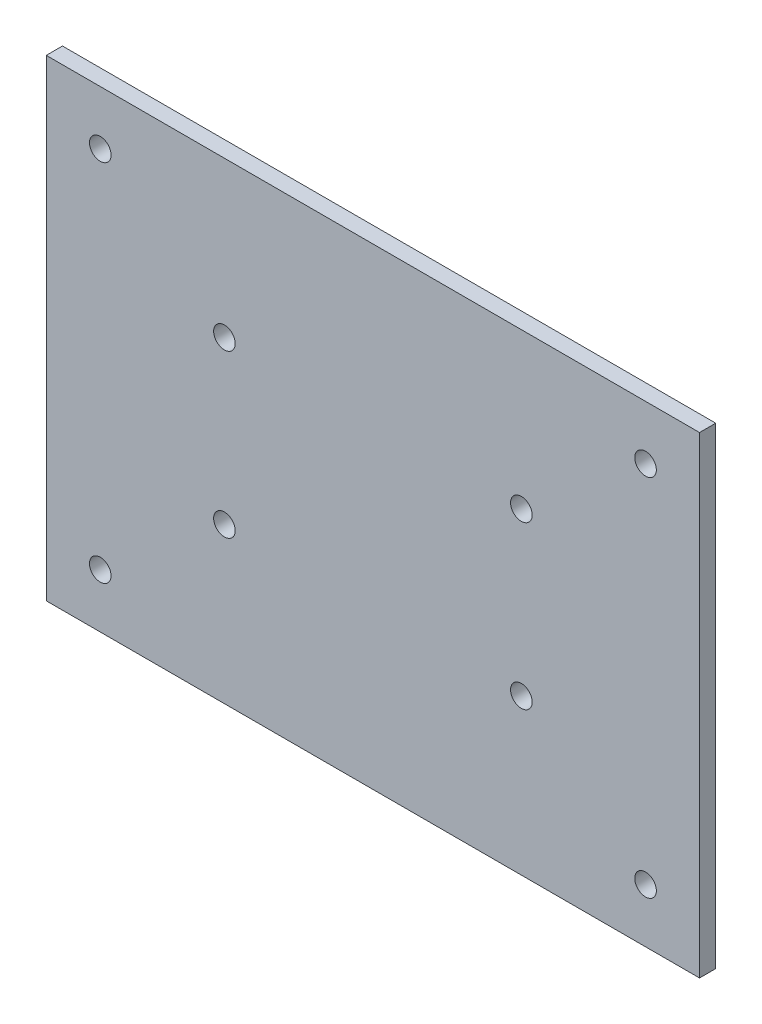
SolidWorks part; units mm, degrees
ref_plane "前视基准面" through (0, 0, 0) normal (0, 0, 1) x (1, 0, 0)
ref_plane "上视基准面" through (0, 0, 0) normal (0, 1, 0) x (1, 0, 0)
ref_plane "右视基准面" through (0, 0, 0) normal (1, 0, 0) x (0, 0, -1)
sketch "草图1" plane through (0, 0, 0) normal (0, 0, 1) x (1, 0, 0)
  line L1 (-60.5, 43.75) -> (60.5, 43.75)
  line L2 (-60.5, 43.75) -> (-60.5, -43.75)
  line L3 (-60.5, -43.75) -> (60.5, -43.75)
  line L4 (60.5, 43.75) -> (60.5, -43.75)
  line L5 (-60.5, 43.75) -> (60.5, -43.75) construction
  line L6 (-60.5, -43.75) -> (60.5, 43.75) construction
  point P0 (0, 0)
  dimension "D1" = 87.5
  dimension "D2" = 121
extrude "凸台-拉伸1" add sketch "草图1" along normal blind 3
hole_wizard "Ø4.0 (4) 直径孔1" positions "草图3" profile "草图4" hole size "Ø4.0" standard "GB"
sketch "草图3" plane through (0, 0, 3) normal (0, 0, 1) x (1, 0, 0)
  point P0 (-27.5, 15)
  point P2 (-27.5, -15)
  point P4 (27.5, 15)
  point P6 (27.5, -15)
  dimension "D1" = 30
  dimension "D2" = 30
  dimension "D3" = 15
  dimension "D4" = 15
  dimension "D5" = 27.5
  dimension "D6" = 27.5
  dimension "D7" = 27.5
  dimension "D8" = 27.5
sketch "草图4" plane through (-27.5, 15, 3) normal (1, 0, 0) x (0, -1, 0)
  line L0 (0, 0) -> (0, 3)
  line L1 (0, 3) -> (2, 3)
  line L2 (2, 3) -> (2, 0)
  line L5 (2, 0) -> (0, 0)
  line L11 (0, -6.35) -> (0, 107.95) construction
  dimension "通孔孔直径" = 4
  dimension "通孔孔深度" = 3
hole_wizard "Ø4.0 (4) 直径孔2" positions "草图5" profile "草图6" hole size "Ø4.0" standard "GB"
sketch "草图5" plane through (0, 0, 3) normal (0, 0, 1) x (1, 0, 0)
  line L0 (60.5, 43.75) -> (-60.5, 43.75) construction
  line L1 (-60.5, 43.75) -> (-60.5, -43.75) construction
  line L2 (60.5, -43.75) -> (60.5, 43.75) construction
  line L3 (-60.5, -43.75) -> (60.5, -43.75) construction
  point P0 (-50.5, 33.75)
  point P2 (-50.5, -33.75)
  point P4 (50.5, 33.75)
  point P6 (50.5, -33.75)
  point P13 (0, 0)
  point P22 (-59.0197, -35.4316)
  dimension "D1" = 10
  dimension "D2" = 10
  dimension "D3" = 10
  dimension "D4" = 10
  dimension "D5" = 10
  dimension "D6" = 10
  dimension "D7" = 10
  dimension "D8" = 10
sketch "草图6" plane through (-50.5, 33.75, 3) normal (1, 0, 0) x (0, -1, 0)
  line L0 (0, 0) -> (0, 3)
  line L1 (0, 3) -> (2, 3)
  line L2 (2, 3) -> (2, 0)
  line L5 (2, 0) -> (0, 0)
  line L11 (0, -6.35) -> (0, 107.95) construction
  dimension "通孔孔直径" = 4
  dimension "通孔孔深度" = 3
